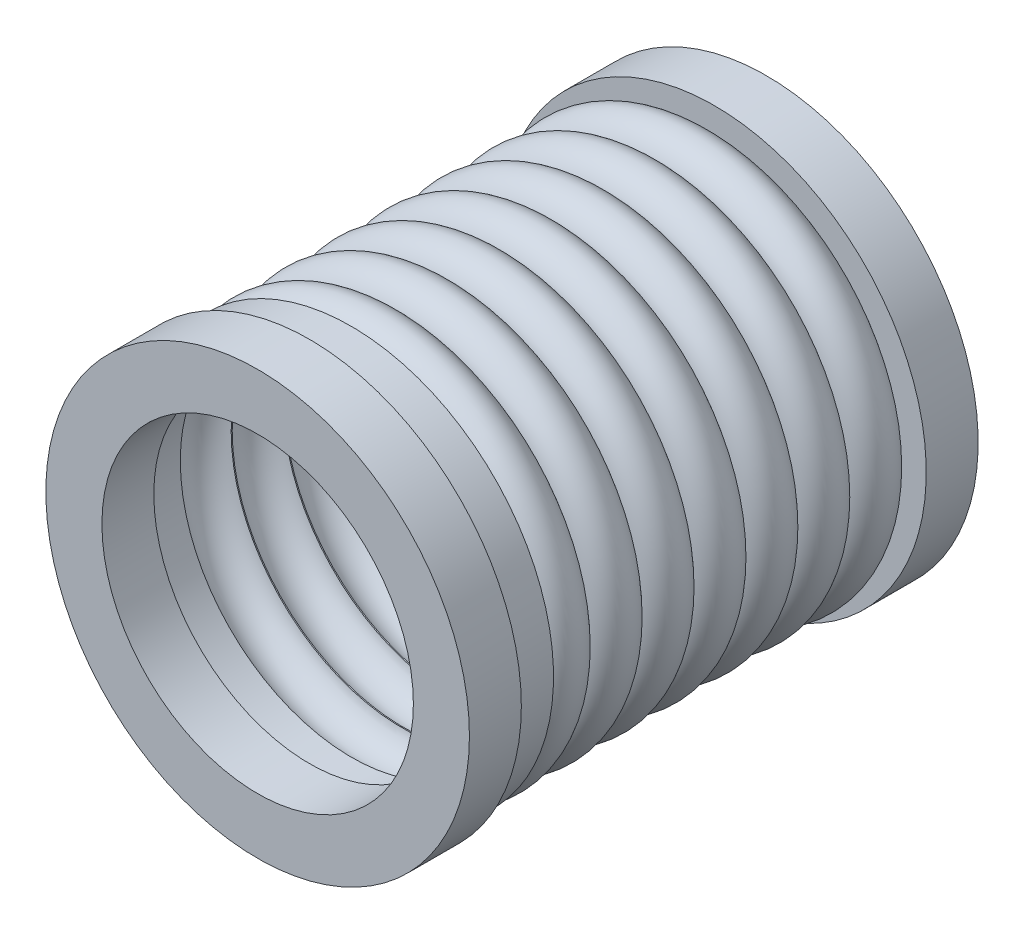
SolidWorks part; units mm, degrees
ref_plane "Front Plane" through (0, 0, 0) normal (0, 0, 1) x (1, 0, 0)
ref_plane "Top Plane" through (0, 0, 0) normal (0, 1, 0) x (1, 0, 0)
ref_plane "Right Plane" through (0, 0, 0) normal (1, 0, 0) x (0, 0, -1)
sketch "Sketch1" plane through (0, 0, 0) normal (0, 0, 1) x (1, 0, 0)
  line L0 (0, 76.5931) -> (0, -86.61) construction
  line L1 (-82.3345, 0) -> (103.59, 0) construction
  circle A0 centre (0, 0) radius 10.4775
  circle A1 centre (0, 0) radius 12.3825
  dimension "D1" = 24.765
  dimension "D2" = 20.955
extrude "Boss-Extrude1" add sketch "Sketch1" along normal blind 24.765
sketch "Sketch2" plane through (0, 0, 0) normal (0, 1, 0) x (1, 0, 0)
  line L0 (12.3825, 0) -> (-12.3825, 0) construction
  line L1 (12.3825, -24.765) -> (12.3825, 0) construction
  line L2 (0, 1.8698) -> (0, -32.5819) construction
  line L3 (10.795, 0) -> (13.335, 0)
  line L5 (10.795, -3.175) -> (13.335, -3.175)
  line L6 (13.335, 0) -> (13.335, -3.175)
  arc A0 (10.795, -3.175) -> (10.795, 0) centre (10.795, -1.5875) ccw
  dimension "D2" = 3.175
  dimension "D1" = 1.5875
  dimension "D3" = 2.54
  dimension "D4" = 3.175
revolve "Cut-Revolve2" cut sketch "Sketch2" angle 360 about L2
pattern_linear "LPattern2" count 7 spacing 3.175 along (0, 0, 1) of "Cut-Revolve2"
sketch "Sketch4" plane through (0, 0, 0) normal (0, 1, 0) x (1, 0, 0)
  line L1 (10.16, -3.175) -> (6.985, -3.175)
  line L2 (10.795, 0) -> (-10.795, 0) construction
  line L3 (10.16, 0) -> (6.985, 0)
  line L4 (6.985, -3.175) -> (6.985, 0)
  arc A0 (10.16, -3.175) -> (10.16, 0) centre (10.16, -1.5875) ccw
  arc A1 (10.795, -3.175) -> (10.795, 0) centre (10.795, -1.5875) ccw construction
  dimension "D1" = 3.175
  dimension "D5" = 0.635
  dimension "D2" = 1.5875
  dimension "D3" = 3.175
  dimension "D4" = 3.175
revolve "Cut-Revolve3" cut sketch "Sketch4" angle 360 about L2
pattern_linear "LPattern3" count 7 spacing 3.175 along (0, 0, 1) of "Cut-Revolve3"
sketch "Sketch6" [suppressed] plane through (0, 0, 0) normal (0, 1, 0) x (1, 0, 0)
  line L0 (-11.43, -17.145) -> (-12.3825, -15.24)
  line L2 (-11.43, -17.145) -> (-11.43, -21.59)
  line L3 (-11.43, -21.59) -> (-14.605, -21.59)
  line L4 (-14.605, -17.145) -> (-14.605, -21.59)
  line L5 (-12.3825, -15.24) -> (-12.3825, -19.05)
  line L6 (-12.3825, -19.05) -> (-13.6525, -19.05)
  line L7 (-13.6525, -19.05) -> (-13.6525, -15.24)
  line L8 (-14.605, -17.145) -> (-13.6525, -15.24)
  line L9 (-13.0175, -15.3829) -> (-13.0175, -21.9451) construction
  dimension "D1" = 1.27
  dimension "D2" = 3.81
  dimension "D3" = 3.175
  dimension "D4" = 1.905
  dimension "D5" = 6.35
revolve "Revolve1" [suppressed] add sketch "Sketch6" angle 360 about L2
sketch "Sketch7" plane through (0, 0, 0) normal (0, 0, -1) x (-1, 0, 0)
  circle A0 centre (0, 0) radius 9.525
  circle A1 centre (0, 0) radius 12.954
  dimension "D1" = 19.05
  dimension "D2" = 25.908
extrude "Boss-Extrude2" add sketch "Sketch7" along normal blind 3.175
sketch "Sketch8" plane through (0, 0, 24.765) normal (0, 0, 1) x (1, 0, 0)
  circle A0 centre (0, 0) radius 12.954
  circle A1 centre (0, 0) radius 9.525
  dimension "D1" = 19.05
  dimension "D2" = 25.908
extrude "Boss-Extrude3" add sketch "Sketch8" along normal blind 3.175
